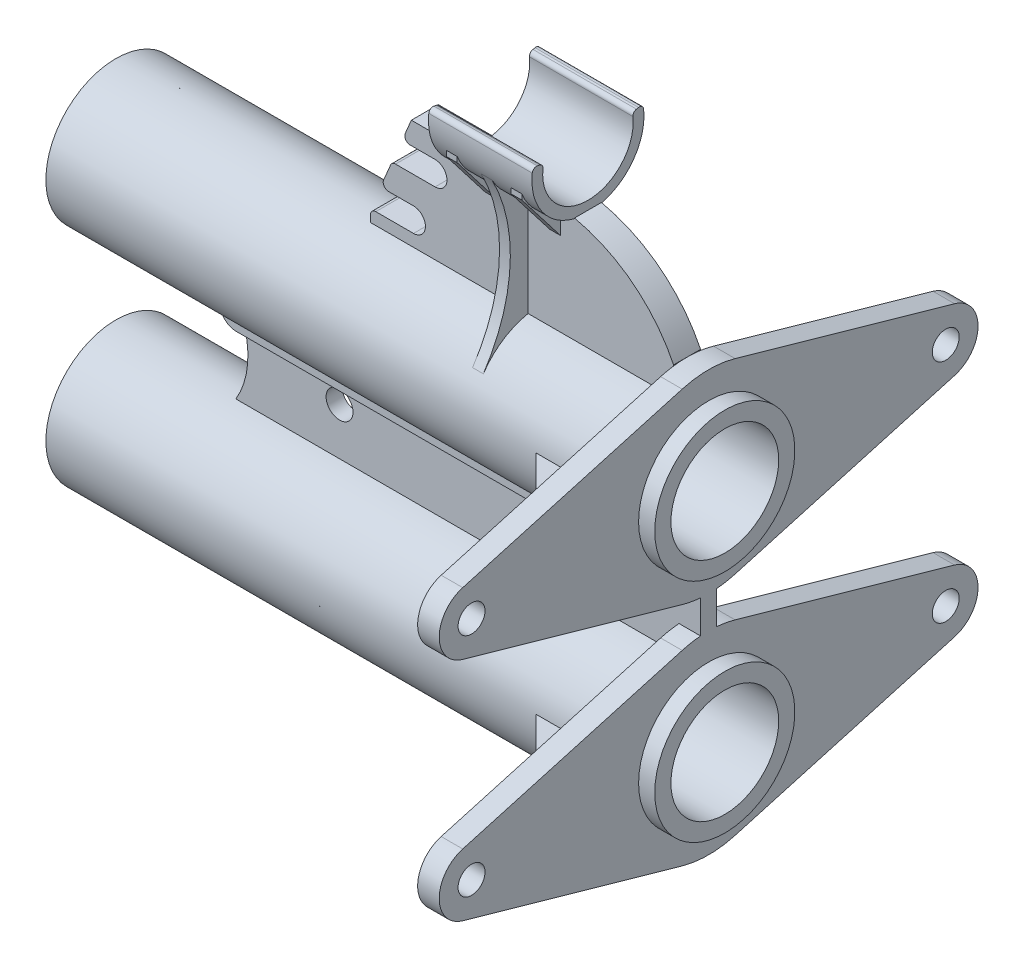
SolidWorks part; units mm, degrees
ref_plane "Front" through (0, 0, 0) normal (0, 0, 1) x (1, 0, 0)
ref_plane "Top" through (0, 0, 0) normal (0, 1, 0) x (1, 0, 0)
ref_plane "Right" through (0, 0, 0) normal (1, 0, 0) x (0, 0, -1)
sketch "Sketch1" plane through (0, 0, 0) normal (1, 0, 0) x (0, 0, -1)
  circle A0 centre (0, 0) radius 8.255
  dimension "D1" = 16.51
extrude "tube" add sketch "Sketch1" against normal blind 69.85
sketch "Sketch2" plane through (0, 0, 0) normal (1, 0, 0) x (0, 0, -1)
  line L0 (27.94, 0) -> (-27.94, 0) construction
  line L1 (-28.9791, 3.6656) -> (-3.1173, 10.9967)
  line L2 (3.1173, 10.9967) -> (28.9791, 3.6656)
  line L3 (28.9791, -3.6656) -> (3.1173, -10.9967)
  line L4 (-28.9791, -3.6656) -> (-3.1173, -10.9967)
  arc A0 (-28.9791, 3.6656) -> (-28.9791, -3.6656) centre (-27.94, 0) ccw
  circle A1 centre (0, 0) radius 11.43
  arc A2 (-3.1173, -10.9967) -> (3.1173, -10.9967) centre (0, 0) ccw
  arc A3 (28.9791, -3.6656) -> (28.9791, 3.6656) centre (27.94, 0) ccw
  arc A4 (3.1173, 10.9967) -> (-3.1173, 10.9967) centre (0, 0) ccw
  circle A5 centre (-27.94, 0) radius 1.5875
  circle A6 centre (27.94, 0) radius 1.5875
  dimension "D2" = 7.62
  dimension "D4" = 3.175
  dimension "D3" = 63.5
  dimension "D1" = 3.175
extrude "flange" add sketch "Sketch2" against normal blind 2.54
sketch "Sketch3" plane through (-69.85, 0, 0) normal (-1, 0, 0) x (0, 0, 1)
  circle A1 centre (0, 0) radius 6.35
  circle A2 centre (0, 0) radius 6.35
  dimension "D1" = 1.905
extrude "hole" cut sketch "Sketch3" against normal through all
sketch "Sketch4" plane through (0, 0, 0) normal (1, 0, 0) x (0, 0, -1)
  circle A0 centre (0, 0) radius 6.35 construction
  circle A1 centre (0, 0) radius 8.255
  circle A2 centre (0, 0) radius 8.255
  circle A3 centre (0, 0) radius 6.35
  dimension "D1" = 1.905
extrude "circular boss" add sketch "Sketch4" along normal blind 1.905
sketch "Sketch6" plane through (0, 0, 0) normal (0, 1, 0) x (1, 0, 0)
  line L0 (-2.54, 7.3025) -> (-13.0175, 7.3025)
  line L1 (-2.54, 7.3025) -> (-2.54, 17.78)
  line L2 (-2.54, 8.255) -> (-69.85, 8.255) construction
  line L4 (-2.54, 3.1173) -> (-2.54, 28.9791) construction
  line L5 (-13.0175, 7.3025) -> (-2.54, 17.78)
  point P7 (-12.065, 8.255)
  dimension "D1" = 0.9525
  dimension "D2" = 9.525
  dimension "D3" = 9.525
extrude "brace" add sketch "Sketch6" along normal mid plane 1.905
mirror "Mirror1" about plane through (0, 0, 0) normal (0, 0, 1) of "brace"
sketch "Sketch5" plane through (0, 0, 0) normal (0, 0, 1) x (1, 0, 0)
  line L0 (0, 7.3025) -> (-55.372, 7.3025)
  line L1 (0, 7.3025) -> (0, 19.3675)
  line L2 (-55.372, 19.3675) -> (0, 19.3675)
  line L3 (-2.54, 8.255) -> (-69.85, 8.255) construction
  line L4 (0, 3.6656) -> (0, 10.9967) construction
  line L5 (-2.54, 8.255) -> (-69.85, 8.255) construction
  line L6 (-63.3105, 18.415) -> (7.5357, 18.415) construction
  arc A0 (-55.372, 7.3025) -> (-55.372, 19.3675) centre (-63.3105, 13.335) ccw
  circle A1 centre (-42.545, 13.7414) radius 1.5875
  circle A2 centre (-12.7, 13.7414) radius 1.5875
  dimension "D6" = 3.175
  dimension "D1" = 0.9525
  dimension "D2" = 53.34
  dimension "D3" = 55.372
  dimension "D4" = 0.9525
  dimension "D5" = 10.16
  dimension "D7" = 12.7
  dimension "D8" = 29.845
  dimension "D9" = 5.4864
extrude "center plate" add sketch "Sketch5" along normal mid plane 1.905
pattern_linear "upper tube&flange" count 2 spacing 26.67 along (0, 1, 0) of "Mirror1", "brace", "tube", "flange", "hole", "circular boss"
sketch "Sketch7" plane through (0, 0, 0) normal (0, 0, 1) x (1, 0, 0)
  line L0 (-33.4455, 47.625) -> (-17.78, 47.625)
  line L1 (-2.54, 34.925) -> (-69.85, 34.925) construction
  line L2 (-2.54, 30.3356) -> (-2.54, 37.6667) construction
  line L3 (-2.54, 33.9725) -> (-2.54, 38.1)
  line L4 (-38.2715, 33.9725) -> (-38.2715, 36.195)
  line L5 (0, 38.1) -> (-2.54, 38.1) construction
  line L6 (-2.54, 33.9725) -> (-69.85, 33.9725)
  line L7 (-2.54, 33.9725) -> (-38.2715, 33.9725)
  line L9 (-38.2715, 36.195) -> (-33.1915, 36.195)
  line L11 (-33.1915, 39.0029) -> (-37.086, 39.0029)
  line L12 (-35.7315, 42.2108) -> (-30.6515, 42.2108)
  line L14 (-30.6515, 45.0187) -> (-34.546, 45.0187)
  line L15 (-34.546, 45.0187) -> (-33.4455, 47.625)
  line L16 (-35.7315, 42.2108) -> (-37.086, 39.0029)
  arc A0 (-2.54, 38.1) -> (-17.78, 47.625) centre (-17.78, 30.6705) ccw
  arc A1 (-33.1915, 39.0029) -> (-33.1915, 36.195) centre (-33.1915, 37.5989) cw
  arc A2 (-30.6515, 42.2108) -> (-30.6515, 45.0187) centre (-30.6515, 43.6147) ccw
  dimension "D3" = 5.08
  dimension "D1" = 12.7
  dimension "D2" = 15.24
  dimension "D5" = 7.62
  dimension "D6" = 1.27
  dimension "D7" = 30.9055
  dimension "D8" = 35.7315
  dimension "D9" = 2.6063
  dimension "D4" = 0.9525
extrude "sight" add sketch "Sketch7" along normal mid plane 3.175
fillet "R025" radius 0.635 4 edges at (-34.546, 45.0187, 0) (-35.7315, 42.2108, 0) (-37.086, 39.0029, 0) (-38.2715, 36.195, 0)
ref_plane "centersupport" through (-20.32, 0, 0) normal (1, 0, 0) x (0, 0, -1)
sketch "Sketch8" plane through (-20.32, 0, 0) normal (1, 0, 0) x (0, 0, -1)
  line L0 (-10.4652, 54.864) -> (5.9346, 54.864) construction
  line L1 (-1.5875, 47.625) -> (1.5875, 47.625) construction
  arc A0 (-6.4807, 54.864) -> (6.4807, 54.864) centre (0, 53.594) ccw
  dimension "D1" = 13.208
  dimension "D2" = 1.27
  dimension "D3" = 0.635
extrude "ammo holder" add sketch "Sketch8" along normal mid plane 12.192 thin
fillet "R020" radius 0.508 4 edges at (-20.32, 54.6198, 5.2344) (-20.32, 54.864, 6.4807) (-20.32, 54.864, -6.4807) (-20.32, 54.6198, -5.2344)
sketch "Sketch9" plane through (-20.32, 0, 0) normal (1, 0, 0) x (0, 0, -1)
  line L0 (1.5875, 38.1) -> (1.5875, 47.2479) construction
  line L1 (0, 50) -> (0, -50) construction
  line L3 (1.5875, 34.7709) -> (1.5875, 47.1836)
  arc A0 (6.8644, 31.2553) -> (1.5875, 34.7709) centre (0, 26.67) ccw
  arc A1 (5.8472, 50.5244) -> (6.8644, 31.2553) centre (22.5693, 41.7457) ccw
  arc A2 (1.5875, 47.1836) -> (6.564, 54.3195) centre (0, 53.594) ccw construction
  circle A3 centre (0, 26.67) radius 8.255 construction
  arc A4 (1.5875, 47.1836) -> (5.8472, 50.5244) centre (0, 53.594) ccw
  dimension "D1" = 3.683
extrude "support" add sketch "Sketch9" against normal mid plane 1.27
ref_plane "brace plane" through (-23.495, 0, 0) normal (-1, 0, 0) x (0, 0, 1)
sketch "Sketch10" plane through (-23.495, 0, 0) normal (-1, 0, 0) x (0, 0, 1)
  line L0 (-1.5875, 44.6436) -> (-6.1428, 50.5345)
  line L2 (-6.1428, 50.5345) -> (-6.1428, 51.1695)
  line L3 (-1.5875, 34.7709) -> (-1.5875, 47.1836) construction
  line L4 (-1.5875, 44.6436) -> (-1.5875, 47.1836)
  line L5 (-1.5875, 47.2479) -> (-1.5875, 38.1) construction
  arc A0 (-6.1428, 51.1695) -> (-1.5875, 47.1836) centre (0, 53.594) ccw
  arc A1 (-6.564, 54.3195) -> (-1.5875, 47.1836) centre (0, 53.594) ccw construction
  arc A2 (-6.6903, 54.3335) -> (-1.618, 47.0604) centre (0, 53.594) ccw
  arc A3 (-6.6903, 54.3335) -> (-0.1539, 46.8648) centre (0, 53.594) ccw construction
  dimension "D1" = 2.54
  dimension "D3" = 0.635
  dimension "D2" = 0.127
extrude "support brace" add sketch "Sketch10" along normal blind 1.27
mirror "Mirror2" about plane through (-20.32, 0, 0) normal (1, 0, 0) of "support brace"
sketch "Sketch11" plane through (-2.54, 0, 0) normal (-1, 0, 0) x (0, 0, 1)
  line L0 (-0.9525, 15.2798) -> (-0.9525, 18.4701) construction
  line L1 (-0.9525, 17.0203) -> (-0.9525, 18.4701)
  line L4 (-2.8575, 17.0203) -> (-0.9525, 17.0203)
  line L5 (-2.8575, 17.0203) -> (-2.8575, 18.9253)
  arc A0 (-8.1999, 25.7175) -> (-0.9525, 18.4701) centre (0, 26.67) ccw construction
  arc A1 (-2.8575, 18.9253) -> (-0.9525, 18.4701) centre (0, 26.67) ccw
  dimension "D1" = 1.905
  dimension "D2" = 1.905
extrude "rail" add sketch "Sketch11" along normal up to surface (51.5061 mm away)
fillet "R075" radius 1.905 1 edges at (-28.293, 17.0203, -2.8575)
mirror "Mirror3" about plane through (0, 0, 0) normal (0, 0, 1) of "R075", "rail", "support", "support brace", "Mirror2"
sketch "Sketch12" [suppressed] plane through (0, 0, 0) normal (0, 1, 0) x (1, 0, 0)
  line L0 (-69.85, 8.255) -> (-69.85, -8.255) construction
  line L1 (-69.85, 0) -> (1.905, 0)
  line L2 (-69.85, 0) -> (-69.85, -31.75)
  line L3 (-69.85, -31.75) -> (1.905, -31.75)
  line L4 (1.905, 0) -> (1.905, -31.75)
  line L5 (1.905, -8.255) -> (1.905, 8.255) construction
  line L6 (-2.54, -31.75) -> (0, -31.75) construction
extrude "Cut-Extrude1" [suppressed] cut sketch "Sketch12" against normal through all and the other way through all
